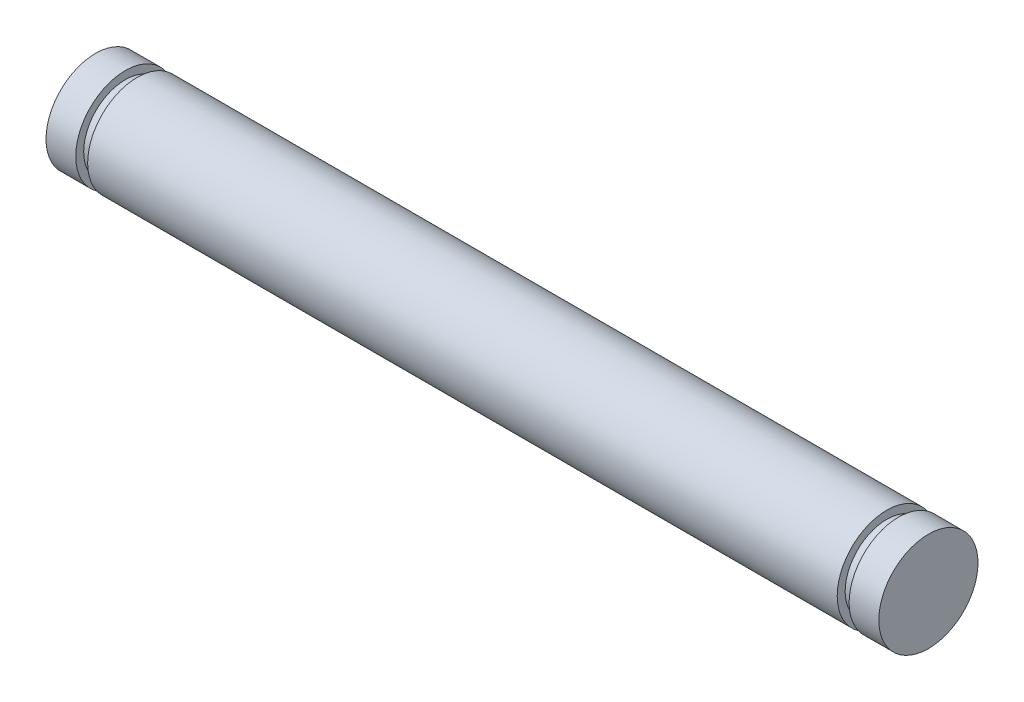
SolidWorks part; units mm, degrees
ref_plane "Front Plane" through (0, 0, 0) normal (0, 0, 1) x (1, 0, 0)
ref_plane "Top Plane" through (0, 0, 0) normal (0, 1, 0) x (1, 0, 0)
ref_plane "Right Plane" through (0, 0, 0) normal (1, 0, 0) x (0, 0, -1)
sketch "Sketch1" plane through (0, 0, 0) normal (1, 0, 0) x (0, 0, -1)
  circle A0 centre (0, 0) radius 3.175
  dimension "D1" = 6.35
extrude "Boss-Extrude1" add sketch "Sketch1" along normal mid plane 53.34 contours A0
sketch "Sketch2" plane through (0, 0, 0) normal (0, 0, 1) x (1, 0, 0)
  line L0 (-26.67, 0) -> (26.67, 0) construction
  line L1 (-26.67, 3.175) -> (-26.67, -3.175) construction
  line L2 (26.67, -3.175) -> (26.67, 3.175) construction
  line L3 (-24.765, 3.175) -> (-24.765, 2.667)
  line L4 (26.67, 3.175) -> (-26.67, 3.175) construction
  line L5 (-24.765, 2.667) -> (-24.003, 2.667)
  line L6 (-24.003, 2.667) -> (-24.003, 3.175)
  line L7 (-24.003, 3.175) -> (-24.765, 3.175)
  line L8 (0, 0) -> (0, 3.175) construction
  line L9 (24.003, 3.175) -> (24.765, 3.175)
  line L10 (24.003, 2.667) -> (24.003, 3.175)
  line L11 (24.765, 2.667) -> (24.003, 2.667)
  line L12 (24.765, 3.175) -> (24.765, 2.667)
  dimension "D1" = 0.762
  dimension "D2" = 24.003
  dimension "D3" = 2.667
  dimension "D4" = 1.905
revolve "Cut-Revolve1" cut sketch "Sketch2" angle 360 about L0
